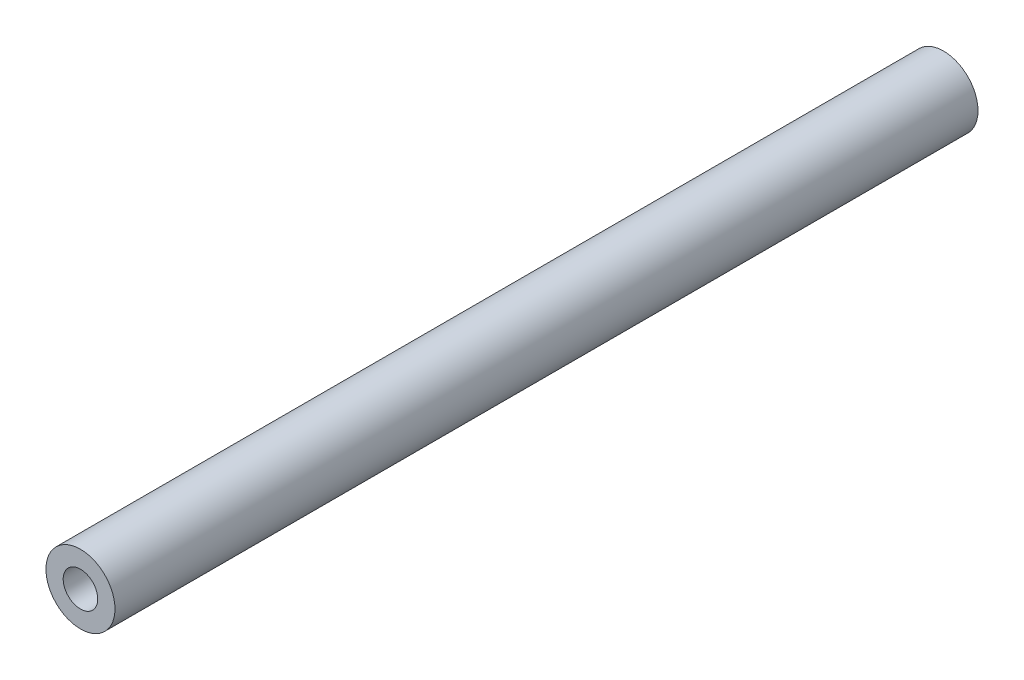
SolidWorks part; units mm, degrees
ref_plane "Спереди" through (0, 0, 0) normal (0, 0, 1) x (1, 0, 0)
ref_plane "Сверху" through (0, 0, 0) normal (0, 1, 0) x (1, 0, 0)
ref_plane "Справа" through (0, 0, 0) normal (1, 0, 0) x (0, 0, -1)
sketch "Эскиз1" plane through (0, 0, 0) normal (0, 0, 1) x (1, 0, 0)
  circle A0 centre (0, 0) radius 1
  circle A1 centre (0, 0) radius 2
  dimension "D1" = 4
  dimension "D2" = 2
extrude "Бобышка-Вытянуть1" add sketch "Эскиз1" along normal blind 50
